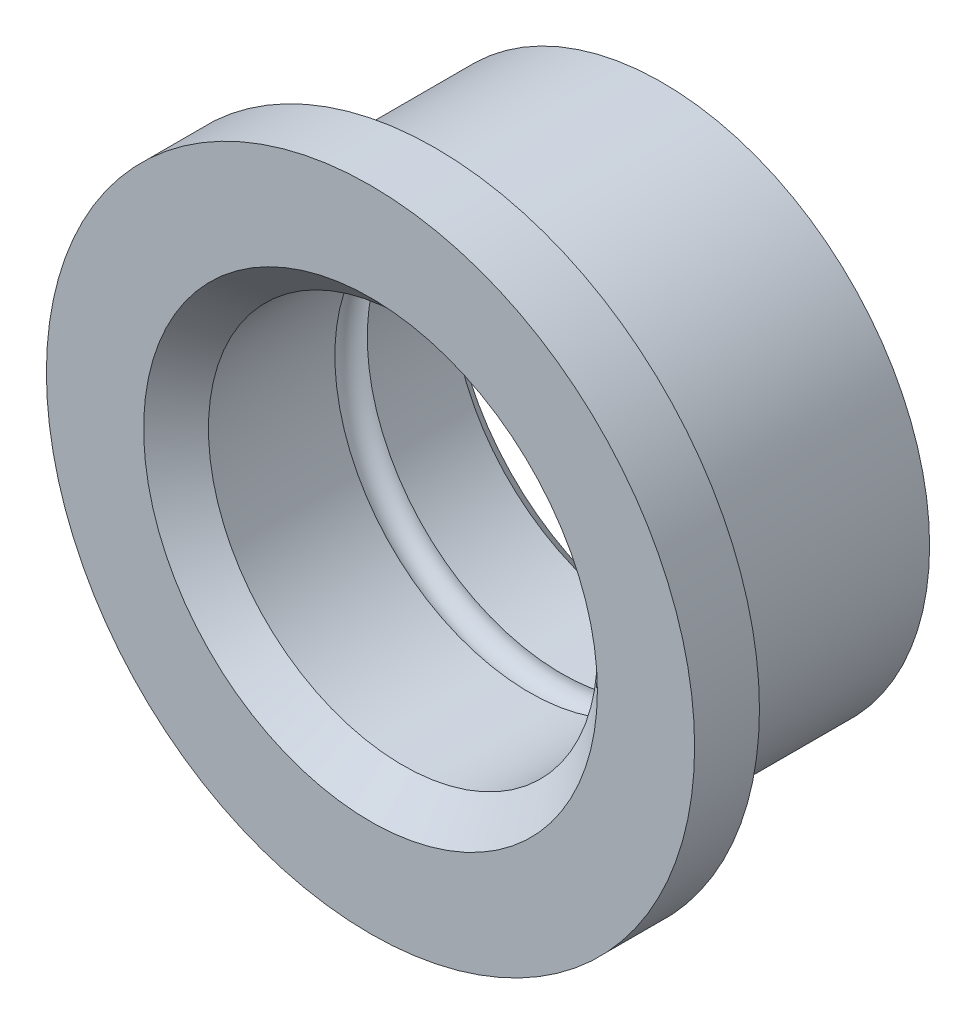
SolidWorks part; units mm, degrees
ref_plane "Plan1" through (0, 0, 0) normal (0, 0, 1) x (1, 0, 0)
ref_plane "Plan2" through (0, 0, 0) normal (0, 1, 0) x (1, 0, 0)
ref_plane "Plan3" through (0, 0, 0) normal (1, 0, 0) x (0, 0, -1)
sketch "Esquisse4" plane through (0, 0, 0) normal (0, 0, 1) x (1, 0, 0)
  circle A0 centre (0, -31.75) radius 8.25 construction
  circle A1 centre (0, -31.75) radius 8.25
  circle A2 centre (0, -31.75) radius 6
  dimension "D1" = 2.25
extrude "Base-Extrusion" add sketch "Esquisse4" against normal blind 7
sketch "Esquisse5" plane through (0, 0, 0) normal (0, 0, 1) x (1, 0, 0)
  circle A0 centre (0, -31.75) radius 6 construction
  circle A1 centre (0, -31.75) radius 6
  circle A2 centre (0, -31.75) radius 10
  dimension "D1" = 4
extrude "Boss.-Extru.2" add sketch "Esquisse5" along normal blind 2
sketch "Esquisse8" plane through (0, 0, 0) normal (0, 0, -1) x (-1, 0, 0)
  line L0 (0, -31.75) -> (12.6062, -31.75) construction
  line L1 (8.0039, -29.75) -> (9.5427, -29.75)
  line L2 (8.0039, -33.75) -> (9.5427, -33.75)
  circle A0 centre (0, -31.75) radius 8.25 construction
  arc A1 (8.0039, -33.75) -> (8.0039, -29.75) centre (0, -31.75) ccw
  arc A2 (9.5427, -33.75) -> (9.5427, -29.75) centre (0, -31.75) ccw
  dimension "D2" = 2
  dimension "D1" = 1.5
extrude "Boss.-Extru.3" add sketch "Esquisse8" along normal blind 4
sketch "Esquisse9" plane through (0, 0, 0) normal (-1, 0, 0) x (0, 0, 1)
  line L0 (2, -25.75) -> (-7, -25.75) construction
  line L1 (-7, -23.5) -> (-7, -40) construction
  line L3 (1.1705, -31.75) -> (-8.5536, -31.75) construction
  line L4 (-7, -31.75) -> (0, -31.75) construction
  line L5 (-2.9, -25.75) -> (-3.9, -25.75)
  arc A0 (-2.9, -25.75) -> (-3.9, -25.75) centre (-3.4, -25.75) ccw
  dimension "D1" = 1
  dimension "D2" = 3.6
revolve "Enlèvement de matière-Révolution1" cut sketch "Esquisse9" angle 360 about L3
chamfer "Chanfrein1" distance 0.5 angle 45
chamfer "Chanfrein2" distance 1 angle 45
